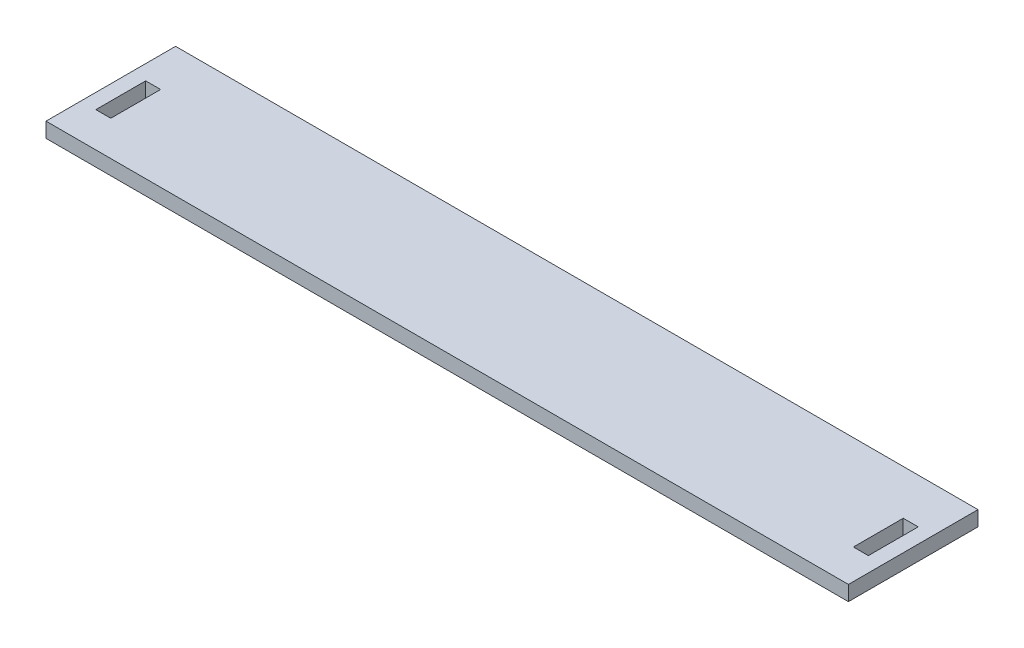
SolidWorks part; units mm, degrees
ref_plane "Front Plane" through (0, 0, 0) normal (0, 0, 1) x (1, 0, 0)
ref_plane "Top Plane" through (0, 0, 0) normal (0, 1, 0) x (1, 0, 0)
ref_plane "Right Plane" through (0, 0, 0) normal (1, 0, 0) x (0, 0, -1)
sketch "Sketch1" plane through (0, 0, 0) normal (0, 1, 0) x (1, 0, 0)
  line L0 (-80.5, -13) -> (-77.5, -13) construction
  line L1 (-80.5, 13) -> (80.5, 13)
  line L2 (-80.5, 13) -> (-80.5, -13)
  line L3 (-80.5, -13) -> (80.5, -13)
  line L4 (80.5, 13) -> (80.5, -13)
  line L5 (-80.5, 13) -> (80.5, -13) construction
  line L6 (-80.5, -13) -> (80.5, 13) construction
  line L7 (80.5, -13) -> (77.5, -13) construction
  line L8 (-77.5, -13) -> (-77.5, 13) construction
  line L9 (77.5, -13) -> (77.5, 13) construction
  line L10 (-77.5, -13) -> (-77.5, -6) construction
  line L11 (77.5, -13) -> (77.5, -6) construction
  line L13 (-77.5, -6) -> (-74.5, -6)
  line L14 (-77.5, -6) -> (-77.5, 4)
  line L15 (-77.5, 4) -> (-74.5, 4)
  line L16 (-74.5, -6) -> (-74.5, 4)
  line L17 (-77.5, -6) -> (-74.5, 4) construction
  line L18 (-77.5, 4) -> (-74.5, -6) construction
  line L19 (77.5, -6) -> (74.5, -6)
  line L20 (77.5, -6) -> (77.5, 4)
  line L21 (77.5, 4) -> (74.5, 4)
  line L22 (74.5, -6) -> (74.5, 4)
  line L23 (77.5, -6) -> (74.5, 4) construction
  line L24 (77.5, 4) -> (74.5, -6) construction
  point P0 (0, 0)
  point P15 (-76, -1)
  point P19 (76, -1)
extrude "Boss-Extrude1" add sketch "Sketch1" along normal blind 3
equation "\"length\"= 161mm"
equation "\"width\"= 26mm"
equation "\"height\"= 3mm"
equation "\"finger_l\"= 10mm"
equation "\"finger_w\"= 3mm"
equation "\"D1@Sketch1\"=\"length\""
equation "\"D2@Sketch1\"=\"width\""
equation "\"D7@Sketch1\"=\"finger_w\""
equation "\"D8@Sketch1\"=\"finger_l\""
equation "\"D9@Sketch1\"=\"finger_w\""
equation "\"D10@Sketch1\"=\"finger_l\""
equation "\"D1@Boss-Extrude1\"=\"height\""
